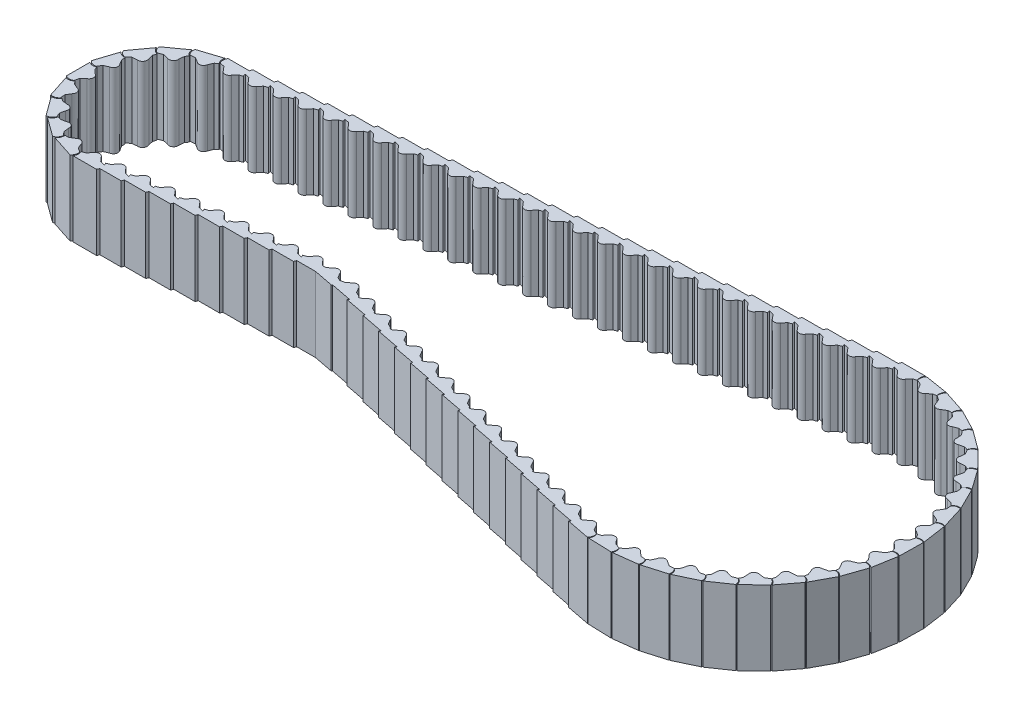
SolidWorks part; units mm, degrees
ref_plane "Front Plane" through (0, 0, 0) normal (0, 0, 1) x (1, 0, 0)
ref_plane "Top Plane" through (0, 0, 0) normal (0, 1, 0) x (1, 0, 0)
ref_plane "Right Plane" through (0, 0, 0) normal (1, 0, 0) x (0, 0, -1)
sketch "Sketch1" plane through (0, 0, 0) normal (0, 1, 0) x (1, 0, 0)
  line L5 (207.137, 52.5812) -> (199.0832, 52.5812)
  line L11 (205.7397, 49.5701) -> (204.5878, 48.2679)
  line L12 (72.1524, -20.6509) -> (2.9781, -28.0066)
  line L13 (201.8122, 48.2679) -> (200.6603, 49.5701)
  line L14 (205.7397, 49.5701) -> (206.8932, 49.9796)
  line L15 (200.6603, 49.5701) -> (199.0162, 49.9796)
  line L16 (215.399, 51.2834) -> (207.4465, 52.5566)
  line L17 (213.5434, 48.5311) -> (212.2001, 47.4274)
  line L18 (-3.3999, 27.9585) -> (199.0832, 52.5812)
  line L19 (189.1803, -50.8732) -> (79.2055, -20.7574)
  line L20 (209.4594, 47.8662) -> (208.5278, 49.334)
  line L21 (213.5434, 48.5311) -> (214.7471, 48.7531)
  line L22 (208.5278, 49.334) -> (206.9691, 49.9983)
  line L23 (223.3521, 48.696) -> (215.7008, 51.2102)
  line L24 (221.0847, 46.2716) -> (219.5838, 45.3941)
  line L25 (216.9469, 46.2606) -> (216.259, 47.8573)
  line L26 (221.0847, 46.2716) -> (222.3084, 46.3005)
  line L27 (216.259, 47.8573) -> (214.825, 48.7596)
  line L28 (230.7961, 44.8839) -> (223.6385, 48.576)
  line L29 (228.174, 42.8484) -> (226.5533, 42.2192)
  line L30 (224.0865, 43.4916) -> (223.6597, 45.177)
  line L31 (228.174, 42.8484) -> (229.3869, 42.6835)
  line L32 (223.6597, 45.177) -> (222.3863, 46.2946)
  line L33 (237.5439, 39.943) -> (231.0599, 44.7201)
  line L34 (234.633, 38.3476) -> (232.9332, 37.9825)
  line L35 (230.6986, 39.6289) -> (230.5436, 41.3605)
  line L36 (234.633, 38.3476) -> (235.8046, 37.9931)
  line L37 (230.5436, 41.3605) -> (229.4629, 42.6653)
  line L38 (243.4259, 33.9976) -> (237.7785, 39.7396)
  line L39 (240.2994, 32.8824) -> (238.5632, 32.7906)
  line L40 (236.617, 34.7695) -> (236.7376, 36.5038)
  line L41 (240.2994, 32.8824) -> (241.4002, 32.3471)
  line L42 (236.7376, 36.5038) -> (235.8768, 37.9631)
  line L43 (248.294, 27.1971) -> (243.6254, 33.7596)
  line L44 (245.0305, 26.5901) -> (243.3017, 26.7739)
  line L45 (241.6928, 29.0356) -> (242.086, 30.7291)
  line L46 (245.0305, 26.5901) -> (246.0329, 25.8876)
  line L47 (242.086, 30.7291) -> (241.4667, 32.3061)
  line L48 (252.026, 19.7126) -> (248.4534, 26.9306)
  line L49 (248.7076, 19.6291) -> (247.0296, 20.0839)
  line L50 (245.7983, 22.5715) -> (246.4544, 24.1815)
  line L51 (248.7076, 19.6291) -> (249.5863, 18.777)
  line L52 (246.4544, 24.1815) -> (246.0921, 25.8366)
  line L53 (254.5279, 11.7322) -> (252.1413, 19.4242)
  line L54 (251.2381, 12.1744) -> (249.653, 12.8887)
  line L55 (248.8305, 15.5396) -> (249.7328, 17.0257)
  line L56 (251.2381, 12.1744) -> (251.971, 11.1941)
  line L57 (249.7328, 17.0257) -> (249.6367, 18.7172)
  line L58 (255.7369, 3.4567) -> (254.5962, 11.4293)
  line L59 (252.5583, 4.4134) -> (251.1061, 5.3693)
  line L60 (250.713, 8.1169) -> (251.8388, 9.4416)
  line L61 (252.5583, 4.4134) -> (253.127, 3.3295)
  line L62 (251.8388, 9.4416) -> (252.0113, 11.1271)
  line L63 (255.6225, -4.9058) -> (255.7564, 3.1468)
  line L64 (252.6351, -3.4587) -> (251.3522, -2.2853)
  line L65 (251.3984, 0.4899) -> (252.7195, 1.62)
  line L66 (252.6351, -3.4587) -> (253.0254, -4.6189)
  line L67 (252.7195, 1.62) -> (253.1563, 3.257)
  line L68 (254.1876, -13.1452) -> (255.5928, -5.2149)
  line L69 (251.4665, -11.244) -> (250.3853, -9.8826)
  line L70 (250.8696, -7.1496) -> (252.3527, -6.2425)
  line L71 (251.4665, -11.244) -> (251.6685, -12.4513)
  line L72 (252.3527, -6.2425) -> (253.0428, -4.6951)
  line L73 (251.4684, -21.0541) -> (254.1094, -13.4457)
  line L74 (249.082, -18.7467) -> (248.2296, -17.2315)
  line L75 (249.1398, -14.6094) -> (250.7477, -13.9481)
  line L76 (249.082, -18.7467) -> (249.0906, -19.9707)
  line L77 (250.7477, -13.9481) -> (251.6736, -12.5293)
  line L78 (247.5331, -28.4337) -> (251.3436, -21.3385)
  line L79 (245.5414, -25.7781) -> (244.9393, -24.1472)
  line L80 (246.2525, -21.7019) -> (247.9447, -21.3032)
  line L81 (245.5414, -25.7781) -> (245.3564, -26.9881)
  line L82 (247.9447, -21.3032) -> (249.0833, -20.0486)
  line L83 (242.4807, -35.0985) -> (247.3649, -28.6948)
  line L84 (240.9339, -32.1615) -> (240.5971, -30.4559)
  line L85 (242.2804, -28.2489) -> (244.0143, -28.1227)
  line L86 (240.9339, -32.1615) -> (240.5599, -33.327)
  line L87 (244.0143, -28.1227) -> (245.337, -27.0638)
  line L88 (236.4383, -40.8808) -> (242.2734, -35.3297)
  line L89 (235.3752, -37.7362) -> (235.3123, -35.9988)
  line L90 (237.3233, -34.0857) -> (239.0554, -34.2351)
  line L91 (235.3752, -37.7362) -> (234.8217, -38.828)
  line L92 (239.0554, -34.2351) -> (240.5288, -33.3987)
  line L93 (229.5579, -45.6353) -> (236.1971, -41.0764)
  line L94 (229.0052, -42.3622) -> (229.2177, -40.6367)
  line L95 (231.5058, -39.0655) -> (233.1925, -39.4869)
  line L96 (229.0052, -42.3622) -> (228.2861, -43.3527)
  line L97 (233.1925, -39.4869) -> (234.7796, -38.8938)
  line L98 (222.0123, -49.2424) -> (229.2887, -45.7902)
  line L99 (221.9841, -45.923) -> (222.4667, -44.2528)
  line L100 (224.9744, -43.0631) -> (226.5733, -43.7458)
  line L101 (221.9841, -45.923) -> (221.1174, -46.7874)
  line L102 (226.5733, -43.7458) -> (228.2341, -43.4111)
  line L103 (213.9915, -51.6113) -> (221.7221, -49.3528)
  line L104 (214.4883, -48.3292) -> (215.2288, -46.7563)
  line L105 (217.8931, -45.9779) -> (219.364, -46.9048)
  line L106 (214.4883, -48.3292) -> (213.4959, -49.0458)
  line L107 (219.364, -46.9048) -> (221.0569, -46.8368)
  line L108 (205.6971, -52.6825) -> (213.6875, -51.6745)
  line L109 (206.7064, -49.5203) -> (207.6863, -48.0842)
  line L110 (210.4401, -47.7367) -> (211.7459, -48.8845)
  line L111 (206.7064, -49.5203) -> (205.6132, -50.0709)
  line L112 (211.7459, -48.8845) -> (213.4283, -49.085)
  line L113 (197.3375, -52.4292) -> (205.3869, -52.6969)
  line L114 (198.8341, -49.4662) -> (200.0287, -48.2031)
  line L115 (202.8027, -48.2953) -> (203.9108, -49.635)
  line L116 (198.8341, -49.4662) -> (197.6676, -49.8371)
  line L117 (203.9108, -49.635) -> (205.5403, -50.099)
  line L118 (189.1232, -50.8575) -> (197.029, -52.3943)
  line L119 (191.0693, -48.1684) -> (192.4485, -47.11)
  line L120 (195.1731, -47.6396) -> (196.0554, -49.1376)
  line L121 (191.0693, -48.1684) -> (189.8588, -48.3503)
  line L122 (196.0554, -49.1376) -> (197.5911, -49.8533)
  line L123 (181.7628, -48.8853) -> (189.6686, -50.4221)
  line L124 (183.7089, -46.1962) -> (185.0882, -45.1378)
  line L125 (187.8128, -45.6674) -> (188.6951, -47.1654)
  line L126 (183.7089, -46.1962) -> (182.4985, -46.3781)
  line L127 (188.6951, -47.1654) -> (190.2308, -47.8811)
  line L128 (174.4025, -46.9131) -> (182.3083, -48.4499)
  line L129 (176.3486, -44.224) -> (177.7278, -43.1656)
  line L130 (180.4524, -43.6952) -> (181.3347, -45.1932)
  line L131 (176.3486, -44.224) -> (175.1381, -44.4059)
  line L132 (181.3347, -45.1932) -> (182.8704, -45.9089)
  line L133 (167.0421, -44.9409) -> (174.9479, -46.4777)
  line L134 (168.9882, -42.2518) -> (170.3675, -41.1934)
  line L135 (173.0921, -41.723) -> (173.9744, -43.221)
  line L136 (168.9882, -42.2518) -> (167.7778, -42.4337)
  line L137 (173.9744, -43.221) -> (175.5101, -43.9367)
  line L138 (159.6818, -42.9687) -> (167.5876, -44.5055)
  line L139 (161.6279, -40.2796) -> (163.0071, -39.2212)
  line L140 (165.7317, -39.7508) -> (166.614, -41.2488)
  line L141 (161.6279, -40.2796) -> (160.4174, -40.4615)
  line L142 (166.614, -41.2488) -> (168.1497, -41.9645)
  line L143 (152.3214, -40.9965) -> (160.2272, -42.5333)
  line L144 (154.2675, -38.3074) -> (155.6468, -37.249)
  line L145 (158.3714, -37.7786) -> (159.2537, -39.2766)
  line L146 (154.2675, -38.3074) -> (153.0571, -38.4893)
  line L147 (159.2537, -39.2766) -> (160.7893, -39.9923)
  line L148 (144.9611, -39.0243) -> (152.8669, -40.5611)
  line L149 (146.9072, -36.3352) -> (148.2864, -35.2768)
  line L150 (151.011, -35.8064) -> (151.8933, -37.3044)
  line L151 (146.9072, -36.3352) -> (145.6967, -36.5171)
  line L152 (151.8933, -37.3044) -> (153.429, -38.0201)
  line L153 (137.6007, -37.0521) -> (145.5065, -38.5889)
  line L154 (139.5468, -34.363) -> (140.926, -33.3046)
  line L155 (143.6507, -33.8342) -> (144.533, -35.3322)
  line L156 (139.5468, -34.363) -> (138.3364, -34.5449)
  line L157 (144.533, -35.3322) -> (146.0686, -36.0479)
  line L158 (130.2404, -35.0799) -> (138.1461, -36.6167)
  line L159 (132.1865, -32.3908) -> (133.5657, -31.3324)
  line L160 (136.2903, -31.862) -> (137.1726, -33.36)
  line L161 (132.1865, -32.3908) -> (130.976, -32.5727)
  line L162 (137.1726, -33.36) -> (138.7083, -34.0757)
  line L163 (122.88, -33.1077) -> (130.7858, -34.6445)
  line L164 (124.8261, -30.4186) -> (126.2053, -29.3602)
  line L165 (128.9299, -29.8898) -> (129.8122, -31.3878)
  line L166 (124.8261, -30.4186) -> (123.6156, -30.6005)
  line L167 (129.8122, -31.3878) -> (131.3479, -32.1035)
  line L168 (115.5196, -31.1355) -> (123.4254, -32.6723)
  line L169 (117.4657, -28.4464) -> (118.845, -27.3879)
  line L170 (121.5696, -27.9176) -> (122.4519, -29.4156)
  line L171 (117.4657, -28.4464) -> (116.2553, -28.6283)
  line L172 (122.4519, -29.4156) -> (123.9876, -30.1313)
  line L173 (108.1593, -29.1633) -> (116.0651, -30.7001)
  line L174 (110.1054, -26.4742) -> (111.4846, -25.4157)
  line L175 (114.2092, -25.9454) -> (115.0915, -27.4434)
  line L176 (110.1054, -26.4742) -> (108.8949, -26.6561)
  line L177 (115.0915, -27.4434) -> (116.6272, -28.1591)
  line L178 (100.7989, -27.1911) -> (108.7047, -28.7279)
  line L179 (102.745, -24.502) -> (104.1243, -23.4435)
  line L180 (106.8489, -23.9732) -> (107.7312, -25.4712)
  line L181 (102.745, -24.502) -> (101.5346, -24.6839)
  line L182 (107.7312, -25.4712) -> (109.2669, -26.1869)
  line L183 (93.4386, -25.2189) -> (101.3444, -26.7557)
  line L184 (95.3847, -22.5298) -> (96.7639, -21.4713)
  line L185 (99.4885, -22.001) -> (100.3708, -23.499)
  line L186 (95.3847, -22.5298) -> (94.1742, -22.7117)
  line L187 (100.3708, -23.499) -> (101.9065, -24.2147)
  line L188 (86.0782, -23.2467) -> (93.984, -24.7835)
  line L189 (88.0243, -20.5576) -> (89.4036, -19.4991)
  line L190 (92.1282, -20.0288) -> (93.0105, -21.5268)
  line L191 (88.0243, -20.5576) -> (86.8139, -20.7395)
  line L192 (93.0105, -21.5268) -> (94.5462, -22.2425)
  line L193 (78.7179, -21.2745) -> (86.6237, -22.8113)
  line L194 (80.664, -18.5854) -> (82.0432, -17.5269)
  line L195 (84.7678, -18.0566) -> (85.6501, -19.5546)
  line L196 (80.664, -18.5854) -> (79.4535, -18.7673)
  line L197 (85.6501, -19.5546) -> (87.1858, -20.2703)
  line L198 (199.5738, 51.6525) -> (191.52, 51.6525)
  line L199 (198.1765, 48.6415) -> (197.0246, 47.3393)
  line L200 (194.249, 47.3393) -> (193.0971, 48.6415)
  line L201 (198.1765, 48.6415) -> (199.33, 49.051)
  line L202 (193.0971, 48.6415) -> (191.453, 49.051)
  line L203 (192.0106, 50.7239) -> (183.9568, 50.7239)
  line L204 (190.6133, 47.7128) -> (189.4614, 46.4107)
  line L205 (186.6858, 46.4107) -> (185.5339, 47.7128)
  line L206 (190.6133, 47.7128) -> (191.7668, 48.1223)
  line L207 (185.5339, 47.7128) -> (183.8898, 48.1223)
  line L208 (184.4474, 49.7952) -> (176.3936, 49.7952)
  line L209 (183.0501, 46.7842) -> (181.8982, 45.482)
  line L210 (179.1226, 45.482) -> (177.9707, 46.7842)
  line L211 (183.0501, 46.7842) -> (184.2036, 47.1937)
  line L212 (177.9707, 46.7842) -> (176.3266, 47.1937)
  line L213 (176.8842, 48.8666) -> (168.8304, 48.8666)
  line L214 (175.4869, 45.8555) -> (174.335, 44.5534)
  line L215 (171.5594, 44.5534) -> (170.4075, 45.8555)
  line L216 (175.4869, 45.8555) -> (176.6404, 46.265)
  line L217 (170.4075, 45.8555) -> (168.7634, 46.265)
  line L218 (169.321, 47.938) -> (161.2672, 47.938)
  line L219 (167.9237, 44.9269) -> (166.7718, 43.6247)
  line L220 (163.9962, 43.6247) -> (162.8443, 44.9269)
  line L221 (167.9237, 44.9269) -> (169.0772, 45.3364)
  line L222 (162.8443, 44.9269) -> (161.2002, 45.3364)
  line L223 (161.7578, 47.0093) -> (153.704, 47.0093)
  line L224 (160.3605, 43.9982) -> (159.2086, 42.6961)
  line L225 (156.433, 42.6961) -> (155.2811, 43.9982)
  line L226 (160.3605, 43.9982) -> (161.514, 44.4077)
  line L227 (155.2811, 43.9982) -> (153.637, 44.4077)
  line L228 (154.1946, 46.0807) -> (146.1408, 46.0807)
  line L229 (152.7973, 43.0696) -> (151.6454, 41.7674)
  line L230 (148.8698, 41.7674) -> (147.7179, 43.0696)
  line L231 (152.7973, 43.0696) -> (153.9508, 43.4791)
  line L232 (147.7179, 43.0696) -> (146.0738, 43.4791)
  line L233 (146.6314, 45.152) -> (138.5776, 45.152)
  line L234 (145.2341, 42.1409) -> (144.0822, 40.8388)
  line L235 (141.3066, 40.8388) -> (140.1547, 42.1409)
  line L236 (145.2341, 42.1409) -> (146.3876, 42.5505)
  line L237 (140.1547, 42.1409) -> (138.5106, 42.5505)
  line L238 (139.0682, 44.2234) -> (131.0144, 44.2234)
  line L239 (137.6709, 41.2123) -> (136.519, 39.9101)
  line L240 (133.7434, 39.9101) -> (132.5914, 41.2123)
  line L241 (137.6709, 41.2123) -> (138.8244, 41.6218)
  line L242 (132.5914, 41.2123) -> (130.9474, 41.6218)
  line L243 (131.505, 43.2947) -> (123.4512, 43.2947)
  line L244 (130.1077, 40.2837) -> (128.9558, 38.9815)
  line L245 (126.1802, 38.9815) -> (125.0282, 40.2837)
  line L246 (130.1077, 40.2837) -> (131.2612, 40.6932)
  line L247 (125.0282, 40.2837) -> (123.3842, 40.6932)
  line L248 (123.9417, 42.3661) -> (115.888, 42.3661)
  line L249 (122.5445, 39.355) -> (121.3926, 38.0529)
  line L250 (118.617, 38.0529) -> (117.465, 39.355)
  line L251 (122.5445, 39.355) -> (123.698, 39.7645)
  line L252 (117.465, 39.355) -> (115.821, 39.7645)
  line L253 (116.3785, 41.4374) -> (108.3248, 41.4374)
  line L254 (114.9813, 38.4264) -> (113.8294, 37.1242)
  line L255 (111.0538, 37.1242) -> (109.9018, 38.4264)
  line L256 (114.9813, 38.4264) -> (116.1348, 38.8359)
  line L257 (109.9018, 38.4264) -> (108.2578, 38.8359)
  line L258 (108.8153, 40.5088) -> (100.7616, 40.5088)
  line L259 (107.4181, 37.4977) -> (106.2662, 36.1956)
  line L260 (103.4906, 36.1956) -> (102.3386, 37.4977)
  line L261 (107.4181, 37.4977) -> (108.5716, 37.9072)
  line L262 (102.3386, 37.4977) -> (100.6946, 37.9072)
  line L263 (101.2521, 39.5802) -> (93.1984, 39.5802)
  line L264 (99.8549, 36.5691) -> (98.703, 35.2669)
  line L265 (95.9274, 35.2669) -> (94.7754, 36.5691)
  line L266 (99.8549, 36.5691) -> (101.0084, 36.9786)
  line L267 (94.7754, 36.5691) -> (93.1314, 36.9786)
  line L268 (93.6889, 38.6515) -> (85.6352, 38.6515)
  line L269 (92.2917, 35.6404) -> (91.1398, 34.3383)
  line L270 (88.3642, 34.3383) -> (87.2122, 35.6404)
  line L271 (92.2917, 35.6404) -> (93.4452, 36.0499)
  line L272 (87.2122, 35.6404) -> (85.5682, 36.0499)
  line L273 (86.1257, 37.7229) -> (78.072, 37.7229)
  line L274 (84.7285, 34.7118) -> (83.5766, 33.4096)
  line L275 (80.801, 33.4096) -> (79.649, 34.7118)
  line L276 (84.7285, 34.7118) -> (85.882, 35.1213)
  line L277 (79.649, 34.7118) -> (78.005, 35.1213)
  line L278 (78.5625, 36.7942) -> (70.5088, 36.7942)
  line L279 (77.1653, 33.7831) -> (76.0134, 32.481)
  line L280 (73.2378, 32.481) -> (72.0858, 33.7831)
  line L281 (77.1653, 33.7831) -> (78.3188, 34.1927)
  line L282 (72.0858, 33.7831) -> (70.4418, 34.1927)
  line L283 (70.9993, 35.8656) -> (62.9456, 35.8656)
  line L284 (69.6021, 32.8545) -> (68.4502, 31.5523)
  line L285 (65.6746, 31.5523) -> (64.5226, 32.8545)
  line L286 (69.6021, 32.8545) -> (70.7556, 33.264)
  line L287 (64.5226, 32.8545) -> (62.8786, 33.264)
  line L288 (63.4361, 34.9369) -> (55.3824, 34.9369)
  line L289 (62.0389, 31.9259) -> (60.887, 30.6237)
  line L290 (58.1114, 30.6237) -> (56.9594, 31.9259)
  line L291 (62.0389, 31.9259) -> (63.1924, 32.3354)
  line L292 (56.9594, 31.9259) -> (55.3154, 32.3354)
  line L293 (55.8729, 34.0083) -> (47.8192, 34.0083)
  line L294 (54.4757, 30.9972) -> (53.3238, 29.6951)
  line L295 (50.5482, 29.6951) -> (49.3962, 30.9972)
  line L296 (54.4757, 30.9972) -> (55.6292, 31.4067)
  line L297 (49.3962, 30.9972) -> (47.7522, 31.4067)
  line L298 (48.3097, 33.0796) -> (40.256, 33.0796)
  line L299 (46.9125, 30.0686) -> (45.7606, 28.7664)
  line L300 (42.985, 28.7664) -> (41.833, 30.0686)
  line L301 (46.9125, 30.0686) -> (48.066, 30.4781)
  line L302 (41.833, 30.0686) -> (40.189, 30.4781)
  line L303 (40.7465, 32.151) -> (32.6928, 32.151)
  line L304 (39.3493, 29.1399) -> (38.1974, 27.8378)
  line L305 (35.4218, 27.8378) -> (34.2698, 29.1399)
  line L306 (39.3493, 29.1399) -> (40.5028, 29.5494)
  line L307 (34.2698, 29.1399) -> (32.6258, 29.5494)
  line L308 (33.1833, 31.2224) -> (25.1296, 31.2224)
  line L309 (31.7861, 28.2113) -> (30.6342, 26.9091)
  line L310 (27.8586, 26.9091) -> (26.7066, 28.2113)
  line L311 (31.7861, 28.2113) -> (32.9396, 28.6208)
  line L312 (26.7066, 28.2113) -> (25.0626, 28.6208)
  line L313 (25.6201, 30.2937) -> (17.5664, 30.2937)
  line L314 (24.2229, 27.2826) -> (23.071, 25.9805)
  line L315 (20.2954, 25.9805) -> (19.1434, 27.2826)
  line L316 (24.2229, 27.2826) -> (25.3764, 27.6921)
  line L317 (19.1434, 27.2826) -> (17.4994, 27.6921)
  line L318 (18.0569, 29.3651) -> (10.0032, 29.3651)
  line L319 (16.6597, 26.354) -> (15.5078, 25.0518)
  line L320 (12.7322, 25.0518) -> (11.5802, 26.354)
  line L321 (16.6597, 26.354) -> (17.8132, 26.7635)
  line L322 (11.5802, 26.354) -> (9.9362, 26.7635)
  line L323 (10.4937, 28.4364) -> (2.44, 28.4364)
  line L324 (9.0965, 25.4253) -> (7.9446, 24.1232)
  line L325 (5.169, 24.1232) -> (4.017, 25.4253)
  line L326 (9.0965, 25.4253) -> (10.25, 25.8349)
  line L327 (4.017, 25.4253) -> (2.373, 25.8349)
  line L328 (2.9305, 27.5078) -> (-5.1232, 27.5078)
  line L329 (1.5333, 24.4967) -> (0.3814, 23.1945)
  line L330 (-2.3942, 23.1945) -> (-3.5462, 24.4967)
  line L331 (1.5333, 24.4967) -> (2.6868, 24.9062)
  line L332 (-3.5462, 24.4967) -> (-5.1902, 24.9062)
  line L333 (-5.7133, 27.067) -> (-13.3729, 24.5783)
  line L334 (-6.1117, 23.7716) -> (-6.8048, 22.1772)
  line L335 (-9.4446, 21.3195) -> (-10.9425, 22.2019)
  line L336 (-6.1117, 23.7716) -> (-5.1411, 24.5175)
  line L337 (-10.9425, 22.2019) -> (-12.6326, 22.0833)
  line L338 (-13.7978, 23.9768) -> (-20.3135, 19.2429)
  line L339 (-13.1583, 20.7195) -> (-13.3249, 18.9889)
  line L340 (-15.5704, 17.3575) -> (-17.2677, 17.7339)
  line L341 (-13.1583, 20.7195) -> (-12.4658, 21.7288)
  line L342 (-17.2677, 17.7339) -> (-18.8385, 17.0988)
  line L343 (-20.5317, 18.5395) -> (-25.2656, 12.0239)
  line L344 (-18.917, 15.6393) -> (-18.5406, 13.9419)
  line L345 (-20.1721, 11.6964) -> (-21.9026, 11.5299)
  line L346 (-18.917, 15.6393) -> (-18.5703, 16.8132)
  line L347 (-21.9026, 11.5299) -> (-23.2003, 10.4405)
  line L348 (-25.2559, 11.2875) -> (-27.7446, 3.6279)
  line L349 (-22.8239, 9.0281) -> (-21.9415, 7.5302)
  line L350 (-22.7992, 4.8904) -> (-24.3936, 4.1973)
  line L351 (-22.8239, 9.0281) -> (-22.8569, 10.2517)
  line L352 (-24.3936, 4.1973) -> (-25.2911, 2.7603)
  line L353 (-27.5078, 2.9305) -> (-27.5078, -5.1232)
  line L354 (-24.4967, 1.5333) -> (-23.1945, 0.3814)
  line L355 (-23.1945, -2.3942) -> (-24.4967, -3.5462)
  line L356 (-24.4967, 1.5333) -> (-24.9062, 2.6868)
  line L357 (-24.4967, -3.5462) -> (-24.9062, -5.1902)
  line L358 (-27.067, -5.7133) -> (-24.5783, -13.3729)
  line L359 (-23.7716, -6.1117) -> (-22.1772, -6.8048)
  line L360 (-21.3195, -9.4446) -> (-22.2019, -10.9425)
  line L361 (-23.7716, -6.1117) -> (-24.5175, -5.1411)
  line L362 (-22.2019, -10.9425) -> (-22.0833, -12.6326)
  line L363 (-23.9768, -13.7978) -> (-19.2429, -20.3135)
  line L364 (-20.7195, -13.1583) -> (-18.9889, -13.3249)
  line L365 (-17.3575, -15.5704) -> (-17.7339, -17.2677)
  line L366 (-20.7195, -13.1583) -> (-21.7288, -12.4658)
  line L367 (-17.7339, -17.2677) -> (-17.0988, -18.8385)
  line L368 (-18.5395, -20.5317) -> (-12.0239, -25.2656)
  line L369 (-15.6393, -18.917) -> (-13.9419, -18.5406)
  line L370 (-11.6964, -20.1721) -> (-11.5299, -21.9026)
  line L371 (-15.6393, -18.917) -> (-16.8132, -18.5703)
  line L372 (-11.5299, -21.9026) -> (-10.4405, -23.2003)
  line L373 (-11.2875, -25.2559) -> (-3.6279, -27.7446)
  line L374 (-9.0281, -22.8239) -> (-7.5302, -21.9415)
  line L375 (-4.8904, -22.7992) -> (-4.1973, -24.3936)
  line L376 (-9.0281, -22.8239) -> (-10.2517, -22.8569)
  line L377 (-4.1973, -24.3936) -> (-2.7603, -25.2911)
  line L378 (-2.9305, -27.5078) -> (5.1232, -27.5078)
  line L379 (-1.5333, -24.4967) -> (-0.3814, -23.1945)
  line L380 (2.3942, -23.1945) -> (3.5462, -24.4967)
  line L381 (-1.5333, -24.4967) -> (-2.6868, -24.9062)
  line L382 (3.5462, -24.4967) -> (5.1902, -24.9062)
  line L383 (4.6477, -26.7113) -> (12.7015, -26.7113)
  line L384 (6.045, -23.7002) -> (7.1969, -22.398)
  line L385 (9.9725, -22.398) -> (11.1244, -23.7002)
  line L386 (6.045, -23.7002) -> (4.8915, -24.1097)
  line L387 (11.1244, -23.7002) -> (12.7685, -24.1097)
  line L388 (12.226, -25.9148) -> (20.2798, -25.9148)
  line L389 (13.6232, -22.9037) -> (14.7752, -21.6015)
  line L390 (17.5508, -21.6015) -> (18.7027, -22.9037)
  line L391 (13.6232, -22.9037) -> (12.4697, -23.3132)
  line L392 (18.7027, -22.9037) -> (20.3467, -23.3132)
  line L393 (19.8042, -25.1183) -> (27.858, -25.1183)
  line L394 (21.2015, -22.1072) -> (22.3534, -20.805)
  line L395 (25.129, -20.805) -> (26.281, -22.1072)
  line L396 (21.2015, -22.1072) -> (20.048, -22.5167)
  line L397 (26.281, -22.1072) -> (27.925, -22.5167)
  line L398 (27.3825, -24.3217) -> (35.4363, -24.3217)
  line L399 (28.7797, -21.3107) -> (29.9317, -20.0085)
  line L400 (32.7073, -20.0085) -> (33.8592, -21.3107)
  line L401 (28.7797, -21.3107) -> (27.6262, -21.7202)
  line L402 (33.8592, -21.3107) -> (35.5032, -21.7202)
  line L403 (34.9608, -23.5252) -> (43.0145, -23.5252)
  line L404 (36.358, -20.5142) -> (37.5099, -19.212)
  line L405 (40.2855, -19.212) -> (41.4375, -20.5142)
  line L406 (36.358, -20.5142) -> (35.2045, -20.9237)
  line L407 (41.4375, -20.5142) -> (43.0815, -20.9237)
  line L408 (42.539, -22.7287) -> (50.5928, -22.7287)
  line L409 (43.9363, -19.7177) -> (45.0882, -18.4155)
  line L410 (47.8638, -18.4155) -> (49.0157, -19.7177)
  line L411 (43.9363, -19.7177) -> (42.7827, -20.1272)
  line L412 (49.0157, -19.7177) -> (50.6597, -20.1272)
  line L413 (50.1173, -21.9322) -> (58.171, -21.9322)
  line L414 (51.5145, -18.9212) -> (52.6664, -17.619)
  line L415 (55.442, -17.619) -> (56.594, -18.9212)
  line L416 (51.5145, -18.9212) -> (50.361, -19.3307)
  line L417 (56.594, -18.9212) -> (58.238, -19.3307)
  line L418 (57.6955, -21.1357) -> (65.7493, -21.1357)
  line L419 (59.0928, -18.1246) -> (60.2447, -16.8225)
  line L420 (63.0203, -16.8225) -> (64.1722, -18.1246)
  line L421 (59.0928, -18.1246) -> (57.9393, -18.5342)
  line L422 (64.1722, -18.1246) -> (65.8163, -18.5342)
  line L423 (65.2738, -20.3392) -> (73.3275, -20.3392)
  line L424 (66.671, -17.3281) -> (67.823, -16.026)
  line L425 (70.5986, -16.026) -> (71.7505, -17.3281)
  line L426 (66.671, -17.3281) -> (65.5175, -17.7376)
  line L427 (71.7505, -17.3281) -> (73.3945, -17.7376)
  line L428 (71.1917, -20.0825) -> (79.0975, -21.6192)
  line L429 (73.1378, -17.3933) -> (74.517, -16.3349)
  line L430 (77.2416, -16.8645) -> (78.1239, -18.3626)
  line L431 (73.1378, -17.3933) -> (71.9273, -17.5752)
  line L432 (78.1239, -18.3626) -> (79.6596, -19.0782)
  arc A3 (189.1803, -50.8732) -> (199.0832, 52.5812) centre (203.1101, -0.0055) ccw
  arc A4 (-3.3999, 27.9585) -> (2.9781, -28.0066) centre (0, 0) ccw
  arc A5 (72.1524, -20.6509) -> (79.2055, -20.7574) centre (75.5575, -28.7465) cw
  arc A6 (209.4594, 47.8662) -> (212.2001, 47.4274) centre (210.9408, 48.3405) ccw
  arc A7 (215.399, 51.2834) -> (214.7471, 48.7531) centre (217.1805, 49.4753) ccw
  arc A8 (206.9691, 49.9983) -> (207.4465, 52.5566) centre (209.4087, 50.8667) cw
  arc A9 (216.9469, 46.2606) -> (219.5838, 45.3941) centre (218.4847, 46.4948) ccw
  arc A10 (223.3521, 48.696) -> (222.3084, 46.3005) centre (224.8253, 46.629) ccw
  arc A11 (214.825, 48.7596) -> (215.7008, 51.2102) centre (217.3712, 49.2315) cw
  arc A12 (224.0865, 43.4916) -> (226.5533, 42.2192) centre (225.6419, 43.4798) ccw
  arc A13 (230.7961, 44.8839) -> (229.3869, 42.6835) centre (231.9241, 42.61) ccw
  arc A14 (222.3863, 46.2946) -> (223.6385, 48.576) centre (224.975, 46.3581) cw
  arc A15 (230.6986, 39.6289) -> (232.9332, 37.9825) centre (232.2326, 39.3713) ccw
  arc A16 (237.5439, 39.943) -> (235.8046, 37.9931) centre (238.2983, 37.5194) ccw
  arc A17 (229.4629, 42.6653) -> (231.0599, 44.7201) centre (232.0291, 42.3188) cw
  arc A18 (236.617, 34.7695) -> (238.5632, 32.7906) centre (238.091, 34.2727) ccw
  arc A19 (243.4259, 33.9976) -> (241.4002, 32.3471) centre (243.7877, 31.4852) ccw
  arc A20 (235.8768, 37.9631) -> (237.7785, 39.7396) centre (238.3559, 37.2153) cw
  arc A21 (241.6928, 29.0356) -> (243.3017, 26.7739) centre (243.0697, 28.312) ccw
  arc A22 (248.294, 27.1971) -> (246.0329, 25.8876) centre (248.2541, 24.6591) ccw
  arc A23 (241.4667, 32.3061) -> (243.6254, 33.7596) centre (243.7965, 31.1758) cw
  arc A24 (245.7983, 22.5715) -> (247.0296, 20.0839) centre (247.0436, 21.6393) ccw
  arc A25 (252.026, 19.7126) -> (249.5863, 18.777) centre (251.5854, 17.2128) ccw
  arc A26 (246.0921, 25.8366) -> (248.4534, 26.9306) centre (248.2139, 24.3522) cw
  arc A27 (248.8305, 15.5396) -> (249.653, 12.8887) centre (249.9128, 14.4224) ccw
  arc A28 (254.5279, 11.7322) -> (251.971, 11.1941) centre (253.6977, 9.3335) ccw
  arc A29 (249.6367, 18.7172) -> (252.1413, 19.4242) centre (251.4972, 16.9161) cw
  arc A30 (250.713, 8.1169) -> (251.1061, 5.3693) centre (251.605, 6.8426) ccw
  arc A31 (255.7369, 3.4567) -> (253.127, 3.3295) centre (254.5379, 1.2194) ccw
  arc A32 (252.0113, 11.1271) -> (254.5962, 11.4293) centre (253.5637, 9.0545) cw
  arc A33 (251.3984, 0.4899) -> (251.3522, -2.2853) centre (252.0778, -0.9094) ccw
  arc A34 (255.6225, -4.9058) -> (253.0254, -4.6189) centre (254.085, -6.9255) ccw
  arc A35 (253.1563, 3.257) -> (255.7564, 3.1468) centre (254.3615, 0.9651) cw
  arc A36 (250.8696, -7.1496) -> (250.3853, -9.8826) centre (251.3192, -8.6387) ccw
  arc A37 (254.1876, -13.1452) -> (251.6685, -12.4513) centre (252.3502, -14.8964) ccw
  arc A38 (253.0428, -4.6951) -> (255.5928, -5.2149) centre (253.8706, -7.1487) cw
  arc A39 (249.1398, -14.6094) -> (248.2296, -17.2315) centre (249.3484, -16.1508) ccw
  arc A40 (251.4684, -21.0541) -> (249.0906, -19.9707) centre (249.3772, -22.4928) ccw
  arc A41 (251.6736, -12.5293) -> (254.1094, -13.4457) centre (252.1032, -15.0829) cw
  arc A42 (246.2525, -21.7019) -> (244.9393, -24.1472) centre (246.2148, -23.257) ccw
  arc A43 (247.5331, -28.4337) -> (245.3564, -26.9881) centre (245.2407, -29.5238) ccw
  arc A44 (249.0833, -20.0486) -> (251.3436, -21.3385) centre (249.1038, -22.638) cw
  arc A45 (242.2804, -28.2489) -> (240.5971, -30.4559) centre (241.9974, -29.7785) ccw
  arc A46 (242.4807, -35.0985) -> (240.5599, -33.327) centre (240.0449, -35.8125) ccw
  arc A47 (245.337, -27.0638) -> (247.3649, -28.6948) centre (244.9478, -29.6239) cw
  arc A48 (237.3233, -34.0857) -> (235.3123, -35.9988) centre (236.802, -35.5513) ccw
  arc A49 (236.4383, -40.8808) -> (234.8217, -38.828) centre (233.9203, -41.2008) ccw
  arc A50 (240.5288, -33.3987) -> (242.2734, -35.3297) centre (239.7398, -35.8651) cw
  arc A51 (231.5058, -39.0655) -> (229.2177, -40.6367) centre (230.7595, -40.4302) ccw
  arc A52 (229.5579, -45.6353) -> (228.2861, -43.3527) centre (227.0209, -45.5532) ccw
  arc A53 (234.7796, -38.8938) -> (236.1971, -41.0764) centre (233.6107, -41.2045) cw
  arc A54 (224.9744, -43.0631) -> (222.4667, -44.2528) centre (224.0217, -44.2927) ccw
  arc A55 (222.0123, -49.2424) -> (221.1174, -46.7874) centre (219.5202, -48.7603) ccw
  arc A56 (228.2341, -43.4111) -> (229.2887, -45.7902) centre (226.7147, -45.5079) cw
  arc A57 (217.8931, -45.9779) -> (215.2288, -46.7563) centre (216.758, -47.0415) ccw
  arc A58 (213.9915, -51.6113) -> (213.4959, -49.0458) centre (211.6069, -50.7413) ccw
  arc A59 (221.0569, -46.8368) -> (221.7221, -49.3528) centre (219.225, -48.6671) cw
  arc A60 (210.4401, -47.7367) -> (207.6863, -48.0842) centre (209.1511, -48.6075) ccw
  arc A61 (205.6971, -52.6825) -> (205.6132, -50.0709) centre (203.48, -51.4466) ccw
  arc A62 (213.4283, -49.085) -> (213.6875, -51.6745) centre (211.3302, -50.6027) cw
  arc A63 (202.8027, -48.2953) -> (200.0287, -48.2031) centre (201.3924, -48.9514) ccw
  arc A64 (197.3375, -52.4292) -> (197.6676, -49.8371) centre (195.3437, -50.8583) ccw
  arc A65 (205.5403, -50.099) -> (205.3869, -52.6969) centre (203.2286, -51.2659) cw
  arc A66 (195.1731, -47.6396) -> (192.4485, -47.11) centre (193.6768, -48.0644) ccw
  arc A67 (189.1232, -50.8575) -> (189.8588, -48.3503) centre (187.4028, -48.9912) ccw
  arc A68 (197.5911, -49.8533) -> (197.029, -52.3943) centre (195.1241, -50.6402) cw
  arc A69 (187.8128, -45.6674) -> (185.0882, -45.1378) centre (186.3164, -46.0922) ccw
  arc A70 (181.7628, -48.8853) -> (182.4985, -46.3781) centre (180.0424, -47.019) ccw
  arc A71 (190.2308, -47.8811) -> (189.6686, -50.4221) centre (187.7637, -48.668) cw
  arc A72 (180.4524, -43.6952) -> (177.7278, -43.1656) centre (178.9561, -44.12) ccw
  arc A73 (174.4025, -46.9131) -> (175.1381, -44.4059) centre (172.6821, -45.0468) ccw
  arc A74 (182.8704, -45.9089) -> (182.3083, -48.4499) centre (180.4034, -46.6958) cw
  arc A75 (173.0921, -41.723) -> (170.3675, -41.1934) centre (171.5957, -42.1478) ccw
  arc A76 (167.0421, -44.9409) -> (167.7778, -42.4337) centre (165.3217, -43.0746) ccw
  arc A77 (175.5101, -43.9367) -> (174.9479, -46.4777) centre (173.043, -44.7236) cw
  arc A78 (165.7317, -39.7508) -> (163.0071, -39.2212) centre (164.2354, -40.1756) ccw
  arc A79 (159.6818, -42.9687) -> (160.4174, -40.4615) centre (157.9614, -41.1024) ccw
  arc A80 (168.1497, -41.9645) -> (167.5876, -44.5055) centre (165.6827, -42.7514) cw
  arc A81 (158.3714, -37.7786) -> (155.6468, -37.249) centre (156.875, -38.2034) ccw
  arc A82 (152.3214, -40.9965) -> (153.0571, -38.4893) centre (150.601, -39.1302) ccw
  arc A83 (160.7893, -39.9923) -> (160.2272, -42.5333) centre (158.3223, -40.7792) cw
  arc A84 (151.011, -35.8064) -> (148.2864, -35.2768) centre (149.5146, -36.2312) ccw
  arc A85 (144.9611, -39.0243) -> (145.6967, -36.5171) centre (143.2406, -37.158) ccw
  arc A86 (153.429, -38.0201) -> (152.8669, -40.5611) centre (150.9619, -38.807) cw
  arc A87 (143.6507, -33.8342) -> (140.926, -33.3046) centre (142.1543, -34.259) ccw
  arc A88 (137.6007, -37.0521) -> (138.3364, -34.5449) centre (135.8803, -35.1858) ccw
  arc A89 (146.0686, -36.0479) -> (145.5065, -38.5889) centre (143.6016, -36.8348) cw
  arc A90 (136.2903, -31.862) -> (133.5657, -31.3324) centre (134.7939, -32.2868) ccw
  arc A91 (130.2404, -35.0799) -> (130.976, -32.5727) centre (128.5199, -33.2136) ccw
  arc A92 (138.7083, -34.0757) -> (138.1461, -36.6167) centre (136.2412, -34.8626) cw
  arc A93 (128.9299, -29.8898) -> (126.2053, -29.3602) centre (127.4336, -30.3146) ccw
  arc A94 (122.88, -33.1077) -> (123.6156, -30.6005) centre (121.1596, -31.2414) ccw
  arc A95 (131.3479, -32.1035) -> (130.7858, -34.6445) centre (128.8809, -32.8904) cw
  arc A96 (121.5696, -27.9176) -> (118.845, -27.3879) centre (120.0732, -28.3424) ccw
  arc A97 (115.5196, -31.1355) -> (116.2553, -28.6283) centre (113.7992, -29.2692) ccw
  arc A98 (123.9876, -30.1313) -> (123.4254, -32.6723) centre (121.5205, -30.9182) cw
  arc A99 (114.2092, -25.9454) -> (111.4846, -25.4157) centre (112.7129, -26.3702) ccw
  arc A100 (108.1593, -29.1633) -> (108.8949, -26.6561) centre (106.4389, -27.297) ccw
  arc A101 (116.6272, -28.1591) -> (116.0651, -30.7001) centre (114.1602, -28.946) cw
  arc A102 (106.8489, -23.9732) -> (104.1243, -23.4435) centre (105.3525, -24.398) ccw
  arc A103 (100.7989, -27.1911) -> (101.5346, -24.6839) centre (99.0785, -25.3248) ccw
  arc A104 (109.2669, -26.1869) -> (108.7047, -28.7279) centre (106.7998, -26.9738) cw
  arc A105 (99.4885, -22.001) -> (96.7639, -21.4713) centre (97.9922, -22.4258) ccw
  arc A106 (93.4386, -25.2189) -> (94.1742, -22.7117) centre (91.7182, -23.3526) ccw
  arc A107 (101.9065, -24.2147) -> (101.3444, -26.7557) centre (99.4395, -25.0016) cw
  arc A108 (92.1282, -20.0288) -> (89.4036, -19.4991) centre (90.6318, -20.4536) ccw
  arc A109 (86.0782, -23.2467) -> (86.8139, -20.7395) centre (84.3578, -21.3804) ccw
  arc A110 (94.5462, -22.2425) -> (93.984, -24.7835) centre (92.0791, -23.0294) cw
  arc A111 (84.7678, -18.0566) -> (82.0432, -17.5269) centre (83.2715, -18.4814) ccw
  arc A112 (78.7179, -21.2745) -> (79.4535, -18.7673) centre (76.9974, -19.4082) ccw
  arc A113 (87.1858, -20.2703) -> (86.6237, -22.8113) centre (84.7188, -21.0572) cw
  arc A114 (194.249, 47.3393) -> (197.0246, 47.3393) centre (195.6368, 48.0419) ccw
  arc A115 (199.5738, 51.6525) -> (199.33, 49.051) centre (201.6187, 50.1488) ccw
  arc A116 (191.453, 49.051) -> (191.52, 51.6525) centre (193.7246, 50.2941) cw
  arc A117 (186.6858, 46.4107) -> (189.4614, 46.4107) centre (188.0736, 47.1132) ccw
  arc A118 (192.0106, 50.7239) -> (191.7668, 48.1223) centre (194.0555, 49.2201) ccw
  arc A119 (183.8898, 48.1223) -> (183.9568, 50.7239) centre (186.1614, 49.3655) cw
  arc A120 (179.1226, 45.482) -> (181.8982, 45.482) centre (180.5104, 46.1846) ccw
  arc A121 (184.4474, 49.7952) -> (184.2036, 47.1937) centre (186.4923, 48.2915) ccw
  arc A122 (176.3266, 47.1937) -> (176.3936, 49.7952) centre (178.5982, 48.4368) cw
  arc A123 (171.5594, 44.5534) -> (174.335, 44.5534) centre (172.9472, 45.2559) ccw
  arc A124 (176.8842, 48.8666) -> (176.6404, 46.265) centre (178.9291, 47.3628) ccw
  arc A125 (168.7634, 46.265) -> (168.8304, 48.8666) centre (171.035, 47.5082) cw
  arc A126 (163.9962, 43.6247) -> (166.7718, 43.6247) centre (165.384, 44.3273) ccw
  arc A127 (169.321, 47.938) -> (169.0772, 45.3364) centre (171.3659, 46.4342) ccw
  arc A128 (161.2002, 45.3364) -> (161.2672, 47.938) centre (163.4718, 46.5796) cw
  arc A129 (156.433, 42.6961) -> (159.2086, 42.6961) centre (157.8208, 43.3986) ccw
  arc A130 (161.7578, 47.0093) -> (161.514, 44.4077) centre (163.8027, 45.5055) ccw
  arc A131 (153.637, 44.4077) -> (153.704, 47.0093) centre (155.9086, 45.6509) cw
  arc A132 (148.8698, 41.7674) -> (151.6454, 41.7674) centre (150.2576, 42.47) ccw
  arc A133 (154.1946, 46.0807) -> (153.9508, 43.4791) centre (156.2395, 44.5769) ccw
  arc A134 (146.0738, 43.4791) -> (146.1408, 46.0807) centre (148.3454, 44.7223) cw
  arc A135 (141.3066, 40.8388) -> (144.0822, 40.8388) centre (142.6944, 41.5413) ccw
  arc A136 (146.6314, 45.152) -> (146.3876, 42.5505) centre (148.6763, 43.6482) ccw
  arc A137 (138.5106, 42.5505) -> (138.5776, 45.152) centre (140.7822, 43.7936) cw
  arc A138 (133.7434, 39.9101) -> (136.519, 39.9101) centre (135.1312, 40.6127) ccw
  arc A139 (139.0682, 44.2234) -> (138.8244, 41.6218) centre (141.1131, 42.7196) ccw
  arc A140 (130.9474, 41.6218) -> (131.0144, 44.2234) centre (133.219, 42.865) cw
  arc A141 (126.1802, 38.9815) -> (128.9558, 38.9815) centre (127.568, 39.6841) ccw
  arc A142 (131.505, 43.2947) -> (131.2612, 40.6932) centre (133.5499, 41.791) ccw
  arc A143 (123.3842, 40.6932) -> (123.4512, 43.2947) centre (125.6558, 41.9363) cw
  arc A144 (118.617, 38.0529) -> (121.3926, 38.0529) centre (120.0048, 38.7554) ccw
  arc A145 (123.9417, 42.3661) -> (123.698, 39.7645) centre (125.9867, 40.8623) ccw
  arc A146 (115.821, 39.7645) -> (115.888, 42.3661) centre (118.0926, 41.0077) cw
  arc A147 (111.0538, 37.1242) -> (113.8294, 37.1242) centre (112.4416, 37.8268) ccw
  arc A148 (116.3785, 41.4374) -> (116.1348, 38.8359) centre (118.4235, 39.9337) ccw
  arc A149 (108.2578, 38.8359) -> (108.3248, 41.4374) centre (110.5294, 40.079) cw
  arc A150 (103.4906, 36.1956) -> (106.2662, 36.1956) centre (104.8784, 36.8981) ccw
  arc A151 (108.8153, 40.5088) -> (108.5716, 37.9072) centre (110.8603, 39.005) ccw
  arc A152 (100.6946, 37.9072) -> (100.7616, 40.5088) centre (102.9662, 39.1504) cw
  arc A153 (95.9274, 35.2669) -> (98.703, 35.2669) centre (97.3152, 35.9695) ccw
  arc A154 (101.2521, 39.5802) -> (101.0084, 36.9786) centre (103.2971, 38.0764) ccw
  arc A155 (93.1314, 36.9786) -> (93.1984, 39.5802) centre (95.403, 38.2218) cw
  arc A156 (88.3642, 34.3383) -> (91.1398, 34.3383) centre (89.752, 35.0408) ccw
  arc A157 (93.6889, 38.6515) -> (93.4452, 36.0499) centre (95.7339, 37.1477) ccw
  arc A158 (85.5682, 36.0499) -> (85.6352, 38.6515) centre (87.8398, 37.2931) cw
  arc A159 (80.801, 33.4096) -> (83.5766, 33.4096) centre (82.1888, 34.1122) ccw
  arc A160 (86.1257, 37.7229) -> (85.882, 35.1213) centre (88.1707, 36.2191) ccw
  arc A161 (78.005, 35.1213) -> (78.072, 37.7229) centre (80.2766, 36.3645) cw
  arc A162 (73.2378, 32.481) -> (76.0134, 32.481) centre (74.6256, 33.1835) ccw
  arc A163 (78.5625, 36.7942) -> (78.3188, 34.1927) centre (80.6075, 35.2904) ccw
  arc A164 (70.4418, 34.1927) -> (70.5088, 36.7942) centre (72.7134, 35.4358) cw
  arc A165 (65.6746, 31.5523) -> (68.4502, 31.5523) centre (67.0624, 32.2549) ccw
  arc A166 (70.9993, 35.8656) -> (70.7556, 33.264) centre (73.0443, 34.3618) ccw
  arc A167 (62.8786, 33.264) -> (62.9456, 35.8656) centre (65.1502, 34.5072) cw
  arc A168 (58.1114, 30.6237) -> (60.887, 30.6237) centre (59.4992, 31.3263) ccw
  arc A169 (63.4361, 34.9369) -> (63.1924, 32.3354) centre (65.4811, 33.4332) ccw
  arc A170 (55.3154, 32.3354) -> (55.3824, 34.9369) centre (57.587, 33.5785) cw
  arc A171 (50.5482, 29.6951) -> (53.3238, 29.6951) centre (51.936, 30.3976) ccw
  arc A172 (55.8729, 34.0083) -> (55.6292, 31.4067) centre (57.9179, 32.5045) ccw
  arc A173 (47.7522, 31.4067) -> (47.8192, 34.0083) centre (50.0238, 32.6499) cw
  arc A174 (42.985, 28.7664) -> (45.7606, 28.7664) centre (44.3728, 29.469) ccw
  arc A175 (48.3097, 33.0796) -> (48.066, 30.4781) centre (50.3547, 31.5759) ccw
  arc A176 (40.189, 30.4781) -> (40.256, 33.0796) centre (42.4606, 31.7212) cw
  arc A177 (35.4218, 27.8378) -> (38.1974, 27.8378) centre (36.8096, 28.5403) ccw
  arc A178 (40.7465, 32.151) -> (40.5028, 29.5494) centre (42.7915, 30.6472) ccw
  arc A179 (32.6258, 29.5494) -> (32.6928, 32.151) centre (34.8974, 30.7926) cw
  arc A180 (27.8586, 26.9091) -> (30.6342, 26.9091) centre (29.2464, 27.6117) ccw
  arc A181 (33.1833, 31.2224) -> (32.9396, 28.6208) centre (35.2283, 29.7186) ccw
  arc A182 (25.0626, 28.6208) -> (25.1296, 31.2224) centre (27.3342, 29.864) cw
  arc A183 (20.2954, 25.9805) -> (23.071, 25.9805) centre (21.6832, 26.683) ccw
  arc A184 (25.6201, 30.2937) -> (25.3764, 27.6921) centre (27.6651, 28.7899) ccw
  arc A511 (201.8122, 48.2679) -> (204.5878, 48.2679) centre (203.2, 48.9705) ccw
  arc A514 (207.137, 52.5812) -> (206.8932, 49.9796) centre (209.1819, 51.0774) ccw
  arc A515 (199.0162, 49.9796) -> (199.0832, 52.5812) centre (201.2878, 51.2228) cw
  arc A516 (17.4994, 27.6921) -> (17.5664, 30.2937) centre (19.771, 28.9353) cw
  arc A517 (12.7322, 25.0518) -> (15.5078, 25.0518) centre (14.12, 25.7544) ccw
  arc A518 (18.0569, 29.3651) -> (17.8132, 26.7635) centre (20.1019, 27.8613) ccw
  arc A519 (9.9362, 26.7635) -> (10.0032, 29.3651) centre (12.2078, 28.0067) cw
  arc A520 (5.169, 24.1232) -> (7.9446, 24.1232) centre (6.5568, 24.8257) ccw
  arc A521 (10.4937, 28.4364) -> (10.25, 25.8349) centre (12.5387, 26.9326) ccw
  arc A522 (2.373, 25.8349) -> (2.44, 28.4364) centre (4.6446, 27.078) cw
  arc A523 (-2.3942, 23.1945) -> (0.3814, 23.1945) centre (-1.0064, 23.8971) ccw
  arc A524 (2.9305, 27.5078) -> (2.6868, 24.9062) centre (4.9754, 26.004) ccw
  arc A525 (-5.1902, 24.9062) -> (-5.1232, 27.5078) centre (-2.9186, 26.1494) cw
  arc A526 (-9.4446, 21.3195) -> (-6.8048, 22.1772) centre (-8.3418, 22.4165) ccw
  arc A527 (-5.7133, 27.067) -> (-5.1411, 24.5175) centre (-3.3037, 26.2688) ccw
  arc A528 (-12.6326, 22.0833) -> (-13.3729, 24.5783) centre (-10.8564, 23.9676) cw
  arc A529 (-15.5704, 17.3575) -> (-13.3249, 18.9889) centre (-14.8606, 18.7416) ccw
  arc A530 (-13.7978, 23.9768) -> (-12.4658, 21.7288) centre (-11.2595, 23.9622) ccw
  arc A531 (-18.8385, 17.0988) -> (-20.3135, 19.2429) centre (-17.7314, 19.4398) cw
  arc A532 (-20.1721, 11.6964) -> (-18.5406, 13.9419) centre (-19.9247, 13.2321) ccw
  arc A533 (-20.5317, 18.5395) -> (-18.5703, 16.8132) centre (-18.1132, 19.31) ccw
  arc A534 (-23.2003, 10.4405) -> (-25.2656, 12.0239) centre (-22.8708, 13.009) cw
  arc A535 (-22.7992, 4.8904) -> (-21.9415, 7.5302) centre (-23.0385, 6.4274) ccw
  arc A536 (-25.2559, 11.2875) -> (-22.8569, 10.2517) centre (-23.1938, 12.7676) ccw
  arc A537 (-25.2911, 2.7603) -> (-27.7446, 3.6279) centre (-25.7714, 5.3048) cw
  arc A538 (-23.1945, -2.3942) -> (-23.1945, 0.3814) centre (-23.8971, -1.0064) ccw
  arc A539 (-27.5078, 2.9305) -> (-24.9062, 2.6868) centre (-26.004, 4.9754) ccw
  arc A540 (-24.9062, -5.1902) -> (-27.5078, -5.1232) centre (-26.1494, -2.9186) cw
  arc A541 (-21.3195, -9.4446) -> (-22.1772, -6.8048) centre (-22.4165, -8.3418) ccw
  arc A542 (-27.067, -5.7133) -> (-24.5175, -5.1411) centre (-26.2688, -3.3037) ccw
  arc A543 (-22.0833, -12.6326) -> (-24.5783, -13.3729) centre (-23.9676, -10.8564) cw
  arc A544 (-17.3575, -15.5704) -> (-18.9889, -13.3249) centre (-18.7416, -14.8606) ccw
  arc A545 (-23.9768, -13.7978) -> (-21.7288, -12.4658) centre (-23.9622, -11.2595) ccw
  arc A546 (-17.0988, -18.8385) -> (-19.2429, -20.3135) centre (-19.4398, -17.7314) cw
  arc A547 (-11.6964, -20.1721) -> (-13.9419, -18.5406) centre (-13.2321, -19.9247) ccw
  arc A548 (-18.5395, -20.5317) -> (-16.8132, -18.5703) centre (-19.31, -18.1132) ccw
  arc A549 (-10.4405, -23.2003) -> (-12.0239, -25.2656) centre (-13.009, -22.8708) cw
  arc A550 (-4.8904, -22.7992) -> (-7.5302, -21.9415) centre (-6.4274, -23.0385) ccw
  arc A551 (-11.2875, -25.2559) -> (-10.2517, -22.8569) centre (-12.7676, -23.1938) ccw
  arc A552 (-2.7603, -25.2911) -> (-3.6279, -27.7446) centre (-5.3048, -25.7714) cw
  arc A553 (2.3942, -23.1945) -> (-0.3814, -23.1945) centre (1.0064, -23.8971) ccw
  arc A554 (-2.9305, -27.5078) -> (-2.6868, -24.9062) centre (-4.9754, -26.004) ccw
  arc A555 (5.1902, -24.9062) -> (5.1232, -27.5078) centre (2.9186, -26.1494) cw
  arc A556 (9.9725, -22.398) -> (7.1969, -22.398) centre (8.5847, -23.1006) ccw
  arc A557 (4.6477, -26.7113) -> (4.8915, -24.1097) centre (2.6028, -25.2075) ccw
  arc A558 (12.7685, -24.1097) -> (12.7015, -26.7113) centre (10.4969, -25.3529) cw
  arc A559 (17.5508, -21.6015) -> (14.7752, -21.6015) centre (16.163, -22.3041) ccw
  arc A560 (12.226, -25.9148) -> (12.4697, -23.3132) centre (10.1811, -24.411) ccw
  arc A561 (20.3467, -23.3132) -> (20.2798, -25.9148) centre (18.0751, -24.5564) cw
  arc A562 (25.129, -20.805) -> (22.3534, -20.805) centre (23.7412, -21.5076) ccw
  arc A563 (19.8042, -25.1183) -> (20.048, -22.5167) centre (17.7593, -23.6145) ccw
  arc A564 (27.925, -22.5167) -> (27.858, -25.1183) centre (25.6534, -23.7599) cw
  arc A565 (32.7073, -20.0085) -> (29.9317, -20.0085) centre (31.3195, -20.7111) ccw
  arc A566 (27.3825, -24.3217) -> (27.6262, -21.7202) centre (25.3376, -22.818) ccw
  arc A567 (35.5032, -21.7202) -> (35.4363, -24.3217) centre (33.2317, -22.9634) cw
  arc A568 (40.2855, -19.212) -> (37.5099, -19.212) centre (38.8977, -19.9146) ccw
  arc A569 (34.9608, -23.5252) -> (35.2045, -20.9237) centre (32.9158, -22.0215) ccw
  arc A570 (43.0815, -20.9237) -> (43.0145, -23.5252) centre (40.8099, -22.1668) cw
  arc A571 (47.8638, -18.4155) -> (45.0882, -18.4155) centre (46.476, -19.1181) ccw
  arc A572 (42.539, -22.7287) -> (42.7827, -20.1272) centre (40.4941, -21.225) ccw
  arc A573 (50.6597, -20.1272) -> (50.5928, -22.7287) centre (48.3882, -21.3703) cw
  arc A574 (55.442, -17.619) -> (52.6664, -17.619) centre (54.0542, -18.3216) ccw
  arc A575 (50.1173, -21.9322) -> (50.361, -19.3307) centre (48.0723, -20.4285) ccw
  arc A576 (58.238, -19.3307) -> (58.171, -21.9322) centre (55.9664, -20.5738) cw
  arc A577 (63.0203, -16.8225) -> (60.2447, -16.8225) centre (61.6325, -17.525) ccw
  arc A578 (57.6955, -21.1357) -> (57.9393, -18.5342) centre (55.6506, -19.6319) ccw
  arc A579 (65.8163, -18.5342) -> (65.7493, -21.1357) centre (63.5447, -19.7773) cw
  arc A580 (70.5986, -16.026) -> (67.823, -16.026) centre (69.2108, -16.7285) ccw
  arc A581 (65.2738, -20.3392) -> (65.5175, -17.7376) centre (63.2289, -18.8354) ccw
  arc A582 (73.3945, -17.7376) -> (73.3275, -20.3392) centre (71.1229, -18.9808) cw
  arc A583 (77.2416, -16.8645) -> (74.517, -16.3349) centre (75.7453, -17.2894) ccw
  arc A584 (71.1917, -20.0825) -> (71.9273, -17.5752) centre (69.4713, -18.2162) ccw
  arc A585 (79.6596, -19.0782) -> (79.0975, -21.6192) centre (77.1926, -19.8651) cw
  point P244 (203.1101, -0.0055)
  point P817 (0, 0)
  dimension "D2" = 16
  dimension "D1" = 22
  dimension "D3" = 28
  dimension "D5" = 10
  dimension "D6" = 2
  dimension "D4" = 11
extrude "Boss-Extrude1" add sketch "Sketch1" along normal blind 25.4 contours L5 A515 L15 L13 A511 L11 L14 A514 | L16 A8 L22 L20 A6 L17 L21 A7 | L23 A11 L27 L25 A9 L24 L26 A10 | L28 A14 L32 L30 A12 L29 L31 A13 | L33 A17 L37 L35 A15 L34 L36 A16 | L38 A20 L42 L40 A18 L39 L41 A19 | L43 A23 L47 L45 A21 L44 L46 A22 | L198 A116 L202 L200 A114 L199 L201 A115 | L203 A119 L207 L205 A117 L204 L206 A118 | L208 A122 L212 L210 A120 L209 L211 A121 | L213 A125 L217 L215 A123 L214 L216 A124 | L218 A128 L222 L220 A126 L219 L221 A127 | L223 A131 L227 L225 A129 L224 L226 A130 | L228 A134 L232 L230 A132 L229 L231 A133 | L233 A137 L237 L235 A135 L234 L236 A136 | L238 A140 L242 L240 A138 L239 L241 A139 | L243 A143 L247 L245 A141 L244 L246 A142 | L248 A146 L252 L250 A144 L249 L251 A145 | L253 A149 L257 L255 A147 L254 L256 A148 | L258 A152 L262 L260 A150 L259 L261 A151 | L263 A155 L267 L265 A153 L264 L266 A154 | L268 A158 L272 L270 A156 L269 L271 A157 | L273 A161 L277 L275 A159 L274 L276 A160 | L278 A164 L282 L280 A162 L279 L281 A163 | L283 A167 L287 L285 A165 L284 L286 A166 | L288 A170 L292 L290 A168 L289 L291 A169 | L293 A173 L297 L295 A171 L294 L296 A172 | L298 A176 L302 L300 A174 L299 L301 A175 | L303 A179 L307 L305 A177 L304 L306 A178 | L308 A182 L312 L310 A180 L309 L311 A181 | L313 A516 L317 L315 A183 L314 L316 A184 | L318 A519 L322 L320 A517 L319 L321 A518 | L323 A522 L327 L325 A520 L324 L326 A521 | L328 A525 L332 L330 A523 L329 L331 A524 | L333 A528 L337 L335 A526 L334 L336 A527 | L338 A531 L342 L340 A529 L339 L341 A530 | L348 A537 L352 L350 A535 L349 L351 A536 | L353 A540 L357 L355 A538 L354 L356 A539 | L358 A543 L362 L360 A541 L359 L361 A542 | L363 A546 L367 L365 A544 L364 L366 A545 | L368 A549 L372 L370 A547 L369 L371 A548 | L343 A534 L347 L345 A532 L344 L346 A533 | L373 A552 L377 L375 A550 L374 L376 A551 | L178 A104 L182 L180 A102 L179 L181 A103 | L183 A107 L187 L185 A105 L184 L186 A106 | L188 A110 L192 L190 A108 L189 L191 A109 | L193 A113 L197 L195 A111 L194 L196 A112 | L173 A101 L177 L175 A99 L174 L176 A100 | L168 A98 L172 L170 A96 L169 L171 A97 | L383 A558 L387 L385 A556 L384 L386 A557 | L163 A95 L167 L165 A93 L164 L166 A94 | L388 A561 L392 L390 A559 L389 L391 A560 | L393 A564 L397 L395 A562 L394 L396 A563 | L403 A570 L407 L405 A568 L404 L406 A569 | L408 A573 L412 L410 A571 L409 L411 A572 | L413 A576 L417 L415 A574 L414 L416 A575 | L423 A582 L427 L425 A580 L424 L426 A581 | L398 A567 L402 L400 A565 L399 L401 A566 | L418 A579 L422 L420 A577 L419 L421 A578 | L378 A555 L382 L380 A553 L379 L381 A554 | L428 A585 L432 L430 A583 L429 L431 A584 | L48 A26 L52 L50 A24 L49 L51 A25 | L53 A29 L57 L55 A27 L54 L56 A28 | L63 A35 L67 L65 A33 L64 L66 A34 | L73 A41 L77 L75 A39 L74 L76 A40 | L78 A44 L82 L80 A42 L79 L81 A43 | L83 A47 L87 L85 A45 L84 L86 A46 | L88 A50 L92 L90 A48 L89 L91 A49 | L93 A53 L97 L95 A51 L94 L96 A52 | L98 A56 L102 L100 A54 L99 L101 A55 | L103 A59 L107 L105 A57 L104 L106 A58 | L113 A65 L117 L115 A63 L114 L116 A64 | L158 A92 L162 L160 A90 L159 L161 A91 | L153 A89 L157 L155 A87 L154 L156 A88 | L128 A74 L132 L130 A72 L129 L131 A73 | L68 A38 L72 L70 A36 L69 L71 A37 | L58 A32 L62 L60 A30 L59 L61 A31 | L108 A62 L112 L110 A60 L109 L111 A61 | L118 A68 L122 L120 A66 L119 L121 A67 | L133 A77 L137 L135 A75 L134 L136 A76 | L138 A80 L142 L140 A78 L139 L141 A79 | L143 A83 L147 L145 A81 L144 L146 A82 | L148 A86 L152 L150 A84 L149 L151 A85 | L123 A71 L127 L125 A69 L124 L126 A70
ref_plane "Plane1" through (0, 0, 0) normal (0, 0, 1) x (1, 0, 0)
ref_plane "Plane3" through (0, 0, 0) normal (1, 0, 0) x (0, 0, -1)
ref_plane "Plane4" through (203.2, 0, 0) normal (1, 0, 0) x (0, 0, -1)
ref_plane "Plane5" through (0, 0, 0) normal (0, 1, 0) x (1, 0, 0)
